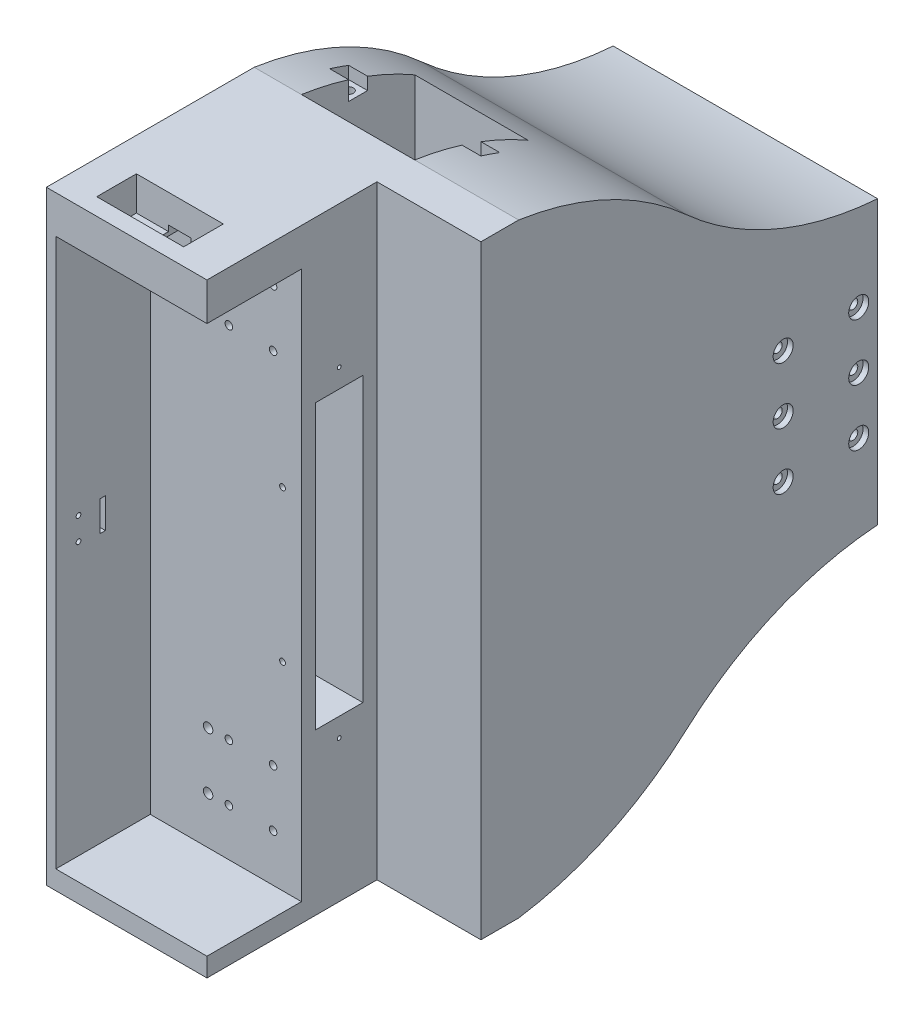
SolidWorks part; units mm, degrees
ref_plane "前视基准面" through (0, 0, 0) normal (0, 0, 1) x (1, 0, 0)
ref_plane "上视基准面" through (0, 0, 0) normal (0, 1, 0) x (1, 0, 0)
ref_plane "右视基准面" through (0, 0, 0) normal (1, 0, 0) x (0, 0, -1)
other "Configuration Table"
sketch "草图1" plane through (0, 0, 0) normal (0, 1, 0) x (1, 0, 0)
  line L0 (0, 0) -> (140, 0)
  line L1 (140, 0) -> (140, -20)
  line L2 (140, -20) -> (85, -20)
  line L3 (85, -20) -> (85, -100)
  line L4 (85, -100) -> (0, -100)
  line L5 (0, -100) -> (0, 0)
  dimension "D1" = 140
  dimension "D2" = 100
  dimension "D3" = 80
  dimension "D4" = 55
extrude "凸台-拉伸1" add sketch "草图1" along normal blind 320
sketch "草图3" plane through (85, 0, 0) normal (1, 0, 0) x (0, 0, -1)
  line L0 (-100, 0) -> (-100, 10)
  line L1 (-100, 10) -> (-50, 10)
  line L2 (-50, 10) -> (-50, 310)
  line L3 (-50, 310) -> (-100, 310)
  line L4 (-100, 0) -> (-20, 0)
  line L5 (-20, 0) -> (-20, 320)
  line L6 (-20, 320) -> (-100, 320)
  line L7 (-100, 320) -> (-100, 0)
  line L8 (-100, 0) -> (-20, 0)
  line L9 (-20, 0) -> (-20, 320)
  line L10 (-20, 320) -> (-100, 320)
  line L11 (-100, 320) -> (-100, 0)
  line L12 (-100, 310) -> (-100, 10)
  dimension "D2" = 10
  dimension "D3" = 10
  dimension "D4" = 50
  dimension "D1" = 0
extrude "切除-拉伸1" cut sketch "草图3" against normal blind 80 contours L2 L3 L1 M10
sketch "草图5" plane through (0, 0, 50) normal (0, 0, 1) x (1, 0, 0)
  line L0 (70, 10) -> (70, 35)
  line L1 (70, 35) -> (85, 35)
  line L2 (46.6, 35) -> (46.6, 65) construction
  line L3 (46.6, 65) -> (46.6, 285) construction
  line L4 (85, 10) -> (85, 310)
  line L5 (85, 310) -> (5, 310)
  line L6 (5, 310) -> (5, 10)
  line L7 (5, 10) -> (85, 10)
  line L8 (85, 10) -> (85, 310)
  line L9 (85, 310) -> (5, 310)
  line L10 (5, 310) -> (5, 10)
  line L11 (5, 10) -> (85, 10)
  circle A0 centre (70, 35) radius 2
  circle A1 centre (46.6, 35) radius 2
  circle A2 centre (46.6, 65) radius 2
  circle A3 centre (70, 65) radius 2
  circle A4 centre (46.6, 285) radius 2
  circle A5 centre (46.6, 255) radius 2
  circle A6 centre (70, 255) radius 2
  circle A7 centre (70, 285) radius 2
  dimension "D4" = 4
  dimension "D2" = 25
  dimension "D3" = 15
  dimension "D6" = 23.4
  dimension "D8" = 30
  dimension "D10" = 220
  dimension "D1" = 0
  dimension "D5" = 2
  dimension "D7" = 2
  dimension "D9" = 2
extrude "切除-拉伸2" cut sketch "草图5" against normal blind 50 contours A2 | A3 | A1 | L1 A0 L0 | L0 A0 L1 | A6 | A4 | A7 | A5
sketch "草图9" plane through (0, 0, 50) normal (0, 0, 1) x (1, 0, 0)
  line L0 (46.6, 285) -> (35.6, 285)
  line L1 (46.6, 255) -> (35.6, 255)
  line L2 (46.6, 65) -> (35.6, 65)
  line L3 (46.6, 35) -> (35.6, 35)
  circle A0 centre (46.6, 285) radius 2 construction
  circle A1 centre (46.6, 285) radius 2
  circle A2 centre (46.6, 255) radius 2 construction
  circle A3 centre (46.6, 255) radius 2
  circle A4 centre (46.6, 65) radius 2 construction
  circle A5 centre (46.6, 65) radius 2
  circle A6 centre (46.6, 35) radius 2 construction
  circle A7 centre (46.6, 35) radius 2
  circle A8 centre (35.6, 285) radius 2.5
  circle A9 centre (35.6, 255) radius 2.5
  circle A10 centre (35.6, 65) radius 2.5
  circle A11 centre (35.6, 35) radius 2.5
  dimension "D3" = 5
  dimension "D4" = 5
  dimension "D7" = 5
  dimension "D8" = 5
  dimension "D1" = 11
  dimension "D2" = 11
  dimension "D5" = 11
  dimension "D6" = 11
extrude "切除-拉伸3" cut sketch "草图9" against normal blind 50
sketch "草图11" plane through (0, 0, 0) normal (0, 0, -1) x (-1, 0, 0)
  line L4 (-140, 0) -> (0, 0)
  line L5 (0, 0) -> (0, 320)
  line L6 (0, 320) -> (-140, 320)
  line L7 (-140, 320) -> (-140, 0)
  line L8 (-140, 0) -> (0, 0)
  line L9 (0, 0) -> (0, 320)
  line L10 (0, 320) -> (-140, 320)
  line L11 (-140, 320) -> (-140, 0)
  circle A0 centre (-35.6, 35) radius 2.5 construction
  circle A1 centre (-46.6, 255) radius 2
  circle A2 centre (-46.6, 255) radius 2
  circle A3 centre (-70, 285) radius 2
  circle A4 centre (-70, 285) radius 2
  circle A5 centre (-46.6, 285) radius 2
  circle A6 centre (-46.6, 285) radius 2
  circle A7 centre (-70, 255) radius 2
  circle A8 centre (-70, 255) radius 2
  circle A9 centre (-35.6, 255) radius 2.5
  circle A10 centre (-35.6, 255) radius 2.5
  circle A11 centre (-35.6, 285) radius 2.5
  circle A12 centre (-35.6, 285) radius 2.5
  circle A13 centre (-35.6, 65) radius 2.5 construction
  circle A14 centre (-46.6, 65) radius 2 construction
  circle A15 centre (-46.6, 35) radius 2 construction
  circle A16 centre (-70, 35) radius 2 construction
  circle A17 centre (-70, 65) radius 2 construction
  circle A18 centre (-35.6, 35) radius 2.5
  circle A19 centre (-35.6, 65) radius 2.5
  circle A20 centre (-46.6, 65) radius 2
  circle A21 centre (-46.6, 35) radius 2
  circle A22 centre (-70, 35) radius 2
  circle A23 centre (-70, 65) radius 2
  dimension "D1" = 0
  dimension "D2" = 0
  dimension "D3" = 0
  dimension "D4" = 0
  dimension "D5" = 0
  dimension "D6" = 0
  dimension "D7" = 0
extrude "凸台-拉伸3" add sketch "草图11" along normal blind 10
sketch "草图12" plane through (0, 0, 20) normal (0, 0, 1) x (1, 0, 0)
  line L4 (85, 0) -> (140, 0)
  line L5 (140, 0) -> (140, 320)
  line L6 (140, 320) -> (85, 320)
  line L7 (85, 320) -> (85, 0)
  line L8 (85, 0) -> (140, 0)
  line L9 (140, 0) -> (140, 320)
  line L10 (140, 320) -> (85, 320)
  line L11 (85, 320) -> (85, 0)
  dimension "D1" = 0
extrude "切除-拉伸4" cut sketch "草图12" against normal blind 10
sketch "草图13" plane through (140, 0, 0) normal (1, 0, 0) x (0, 0, -1)
  line L0 (10, 160) -> (10, 234.75)
  line L1 (200, 160) -> (200, 85.25)
  line L2 (200, 160) -> (200, 234.75)
  line L3 (200, 160) -> (-49800, 160) construction
  line L4 (-10, 320) -> (-10, 0)
  line L5 (-10, 0) -> (10, 0)
  line L6 (10, 0) -> (10, 320)
  line L7 (10, 320) -> (-10, 320)
  line L8 (-10, 320) -> (-10, 0)
  line L9 (-10, 0) -> (10, 0)
  line L10 (10, 0) -> (10, 320)
  line L11 (10, 320) -> (-10, 320)
  arc A0 (200, 234.75) -> (98.848, 277.9963) centre (212.2529, 403.3284) cw
  arc A1 (98.848, 42.0037) -> (10, 0) centre (-14.9754, 167.7983) cw
  arc A2 (98.848, 277.9963) -> (10, 320) centre (-14.9754, 152.2017) ccw
  arc A3 (200, 85.25) -> (98.848, 42.0037) centre (212.2529, -83.3284) ccw
  dimension "D2" = 74.75
  dimension "D4" = 190
  dimension "D1" = 0
  dimension "D3" = 2
extrude "凸台-拉伸4" add sketch "草图13" against normal up to surface (140 mm away)
sketch "草图15" plane through (0, 0, 0) normal (-1, 0, 0) x (0, 0, 1)
  line L0 (-10, 320) -> (100, 320) construction
  line L1 (-10, 320) -> (100, 320)
  line L2 (-10, 0) -> (100, 0) construction
  line L3 (-10, 0) -> (100, 0)
  line L4 (-10, 0) -> (-10, 80)
  line L5 (-10, 320) -> (-10, 240)
  line L6 (-10, 80) -> (-70, 80)
  line L7 (-10, 240) -> (-70, 240)
  line L8 (-70, 80) -> (-70, 20.9677)
  line L9 (-70, 240) -> (-70, 299.0323)
  arc A0 (-98.848, 42.0037) -> (-10, 0) centre (14.9754, 167.7983) ccw construction
  arc A1 (-10, 320) -> (-98.848, 277.9963) centre (14.9754, 152.2017) ccw construction
  arc A2 (-10, 320) -> (-98.848, 277.9963) centre (14.9754, 152.2017) ccw
  arc A3 (-98.848, 42.0037) -> (-10, 0) centre (14.9754, 167.7983) ccw
  dimension "D3" = 60
  dimension "D1" = 80
  dimension "D2" = 80
  dimension "D4" = 60
extrude "切除-拉伸5" cut sketch "草图15" against normal blind 60 from offset 25 contours L6 L8 L4 M12 | L9 L7 L5 M8
sketch "草图16" plane through (85, 0, 0) normal (1, 0, 0) x (0, 0, -1)
  line L0 (-50, 160) -> (-42.5, 160)
  line L1 (-42.5, 85) -> (-42.5, 235)
  line L2 (-42.5, 235) -> (-17.5, 235)
  line L3 (-17.5, 235) -> (-17.5, 85)
  line L4 (-17.5, 160) -> (-42.5, 160)
  line L5 (-42.5, 85) -> (-17.5, 85)
  line L8 (-50, 310) -> (-50, 10)
  line L9 (-50, 10) -> (-100, 10)
  line L10 (-100, 10) -> (-100, 0)
  line L11 (-100, 0) -> (-10, 0)
  line L12 (-10, 0) -> (-10, 320)
  line L13 (-10, 320) -> (-100, 320)
  line L14 (-100, 320) -> (-100, 310)
  line L15 (-100, 310) -> (-50, 310)
  line L16 (-50, 310) -> (-50, 10)
  line L17 (-50, 10) -> (-100, 10)
  line L18 (-100, 10) -> (-100, 0)
  line L19 (-100, 0) -> (-10, 0)
  line L20 (-10, 0) -> (-10, 320)
  line L21 (-10, 320) -> (-100, 320)
  line L22 (-100, 320) -> (-100, 310)
  line L23 (-100, 310) -> (-50, 310)
  dimension "D2" = 7.5
  dimension "D3" = 25
  dimension "D4" = 75
  dimension "D1" = 0
extrude "切除-拉伸6" cut sketch "草图16" against normal blind 60 contours L4 L3 L2 L1 | L1 L5 L3 L4
sketch "草图17" plane through (0, 0, -200) normal (0, 0, -1) x (-1, 0, 0)
  line L1 (-120, 204.75) -> (-20, 204.75)
  line L2 (-120, 204.75) -> (-120, 115.25)
  line L3 (-120, 115.25) -> (-20, 115.25)
  line L4 (0, 85.25) -> (0, 234.75)
  line L5 (0, 234.75) -> (-140, 234.75)
  line L6 (-140, 234.75) -> (-140, 85.25)
  line L7 (-140, 85.25) -> (0, 85.25)
  line L8 (0, 85.25) -> (0, 234.75)
  line L9 (0, 234.75) -> (-140, 234.75)
  line L10 (-140, 234.75) -> (-140, 85.25)
  line L11 (-140, 85.25) -> (0, 85.25)
  line L12 (-20, 204.75) -> (-20, 115.25)
  line L13 (-120, 204.75) -> (-20, 115.25) construction
  line L14 (-120, 115.25) -> (-20, 204.75) construction
  point P2 (-70, 160)
  dimension "D2" = 100
  dimension "D3" = 89.5
  dimension "D4" = 20
  dimension "D5" = 30
  dimension "D1" = 0
extrude "切除-拉伸8" cut sketch "草图17" against normal blind 61 contours L12 L1 L2 L3
sketch "草图19" plane through (20, 0, 0) normal (1, 0, 0) x (0, 0, -1)
  line L0 (200, 160) -> (139, 160)
  line L1 (190, 160) -> (150, 160) construction
  line L2 (190, 160) -> (190, 190) construction
  line L4 (200, 115.25) -> (200, 204.75)
  line L5 (200, 204.75) -> (139, 204.75)
  line L6 (139, 204.75) -> (139, 115.25)
  line L7 (139, 115.25) -> (200, 115.25)
  line L8 (200, 115.25) -> (200, 204.75)
  line L9 (200, 204.75) -> (139, 204.75)
  line L10 (139, 204.75) -> (139, 115.25)
  line L11 (139, 115.25) -> (200, 115.25)
  circle A0 centre (190, 160) radius 2.5
  circle A1 centre (150, 160) radius 2.5
  circle A2 centre (150, 190) radius 2.5
  circle A3 centre (190, 190) radius 2.5
  circle A4 centre (150, 130) radius 2.5
  circle A5 centre (190, 130) radius 2.5
  dimension "D2" = 5
  dimension "D3" = 10
  dimension "D6" = 40
  dimension "D7" = 30
  dimension "D1" = 0
  dimension "D4" = 2
  dimension "D5" = 2
extrude "切除-拉伸9" cut sketch "草图19" against normal through all both and the other way through all contours A3 | A2 | A1 | A0 | A5 | A4
sketch "草图20" plane through (140, 0, 0) normal (1, 0, 0) x (0, 0, -1)
  circle A0 centre (150, 130) radius 2.5 construction
  circle A1 centre (190, 130) radius 2.5 construction
  circle A2 centre (190, 160) radius 2.5 construction
  circle A3 centre (150, 160) radius 2.5 construction
  circle A4 centre (150, 190) radius 2.5 construction
  circle A5 centre (190, 190) radius 2.5 construction
  circle A6 centre (150, 130) radius 2.5
  circle A7 centre (190, 130) radius 2.5
  circle A8 centre (190, 160) radius 2.5
  circle A9 centre (150, 160) radius 2.5
  circle A10 centre (150, 190) radius 2.5
  circle A11 centre (190, 190) radius 2.5
  circle A12 centre (190, 190) radius 5.3
  circle A13 centre (150, 190) radius 5.3
  circle A14 centre (150, 160) radius 5.3
  circle A15 centre (190, 160) radius 5.3
  circle A16 centre (190, 130) radius 5.3
  circle A17 centre (150, 130) radius 5.3
  dimension "D1" = 10.6
  dimension "D2" = 10.6
  dimension "D3" = 10.6
  dimension "D4" = 10.6
  dimension "D5" = 10.6
  dimension "D6" = 10.6
extrude "切除-拉伸10" cut sketch "草图20" against normal blind 3 and the other way through all
sketch "草图21" plane through (0, 0, 0) normal (-1, 0, 0) x (0, 0, 1)
  circle A0 centre (-150, 130) radius 5.3 construction
  circle A1 centre (-150, 160) radius 5.3
  circle A2 centre (-150, 160) radius 5.3
  circle A3 centre (-150, 190) radius 5.3 construction
  circle A4 centre (-190, 190) radius 5.3 construction
  circle A5 centre (-190, 160) radius 5.3 construction
  circle A6 centre (-190, 130) radius 5.3 construction
  circle A7 centre (-150, 130) radius 5.3
  circle A8 centre (-150, 190) radius 5.3
  circle A9 centre (-190, 190) radius 5.3
  circle A10 centre (-190, 160) radius 5.3
  circle A11 centre (-190, 130) radius 5.3
  dimension "D1" = 0
extrude "切除-拉伸11" cut sketch "草图21" against normal blind 3
sketch "草图22" plane through (0, 0, -139) normal (0, 0, -1) x (-1, 0, 0)
  line L0 (-70, 204.75) -> (-70, 115.25)
  line L1 (-120, 160) -> (-20, 160)
  line L3 (-105.5, 195.5) -> (-34.5, 195.5)
  line L4 (-20, 115.25) -> (-20, 204.75)
  line L5 (-20, 204.75) -> (-120, 204.75)
  line L6 (-120, 204.75) -> (-120, 115.25)
  line L7 (-120, 115.25) -> (-20, 115.25)
  line L8 (-20, 115.25) -> (-20, 204.75)
  line L9 (-20, 204.75) -> (-120, 204.75)
  line L10 (-120, 204.75) -> (-120, 115.25)
  line L11 (-120, 115.25) -> (-20, 115.25)
  line L12 (-105.5, 195.5) -> (-105.5, 124.5)
  line L13 (-105.5, 124.5) -> (-34.5, 124.5)
  line L14 (-34.5, 195.5) -> (-34.5, 124.5)
  line L15 (-105.5, 195.5) -> (-34.5, 124.5) construction
  line L16 (-105.5, 124.5) -> (-34.5, 195.5) construction
  point P8 (-70, 160)
  dimension "D2" = 71
  dimension "D3" = 71
  dimension "D1" = 0
extrude "切除-拉伸12" cut sketch "草图22" against normal blind 71 contours L3 L12 L1 L0 | L14 L3 L0 L1 | L14 L1 L0 L13 | L12 L13 L0 L1
sketch "草图23" plane through (0, 0, 0) normal (-1, 0, 0) x (0, 0, 1)
  line L0 (100, 160) -> (90, 160)
  line L1 (90, 170) -> (90, 150)
  line L2 (90, 150) -> (70, 150)
  line L3 (70, 150) -> (70, 170)
  line L4 (-10, 0) -> (100, 0)
  line L5 (100, 0) -> (100, 320)
  line L6 (100, 320) -> (-10, 320)
  line L7 (-200, 234.75) -> (-200, 85.25)
  line L8 (-10, 0) -> (100, 0)
  line L9 (100, 0) -> (100, 320)
  line L10 (100, 320) -> (-10, 320)
  line L11 (-200, 234.75) -> (-200, 85.25)
  line L12 (70, 160) -> (90, 160)
  line L13 (90, 170) -> (70, 170)
  arc A4 (-10, 320) -> (-98.848, 277.9963) centre (14.9754, 152.2017) ccw
  arc A5 (-200, 234.75) -> (-98.848, 277.9963) centre (-212.2529, 403.3284) ccw
  arc A6 (-98.848, 42.0037) -> (-200, 85.25) centre (-212.2529, -83.3284) ccw
  arc A7 (-98.848, 42.0037) -> (-10, 0) centre (14.9754, 167.7983) ccw
  arc A8 (-10, 320) -> (-98.848, 277.9963) centre (14.9754, 152.2017) ccw
  arc A9 (-200, 234.75) -> (-98.848, 277.9963) centre (-212.2529, 403.3284) ccw
  arc A10 (-98.848, 42.0037) -> (-200, 85.25) centre (-212.2529, -83.3284) ccw
  arc A11 (-98.848, 42.0037) -> (-10, 0) centre (14.9754, 167.7983) ccw
  dimension "D2" = 10
  dimension "D3" = 20
  dimension "D4" = 10
  dimension "D1" = 0
extrude "切除-拉伸13" cut sketch "草图23" against normal blind 2 contours L12 L3 L2 L1 | L1 L13 L3 L12
sketch "草图24" plane through (2, 0, 0) normal (-1, 0, 0) x (0, 0, 1)
  line L0 (70, 152) -> (73.75, 152)
  line L1 (73.75, 152) -> (73.75, 150)
  line L3 (73.75, 152) -> (76.75, 152)
  line L4 (90, 150) -> (90, 170)
  line L5 (90, 170) -> (70, 170)
  line L6 (70, 170) -> (70, 150)
  line L7 (70, 150) -> (90, 150)
  line L8 (90, 150) -> (90, 170)
  line L9 (90, 170) -> (70, 170)
  line L10 (70, 170) -> (70, 150)
  line L11 (70, 150) -> (90, 150)
  line L12 (73.75, 152) -> (73.75, 168)
  line L13 (73.75, 168) -> (76.75, 168)
  line L14 (76.75, 152) -> (76.75, 168)
  dimension "D2" = 3.75
  dimension "D3" = 2
  dimension "D4" = 16
  dimension "D5" = 3
  dimension "D1" = 0
extrude "切除-拉伸14" cut sketch "草图24" against normal blind 12 contours L3 L14 L13 L12
sketch "草图25" plane through (2, 0, 0) normal (-1, 0, 0) x (0, 0, 1)
  line L0 (90, 160) -> (88, 160)
  line L1 (88, 160) -> (88, 166)
  line L4 (90, 150) -> (90, 170)
  line L5 (90, 170) -> (70, 170)
  line L6 (70, 170) -> (70, 150)
  line L7 (70, 150) -> (90, 150)
  line L8 (90, 150) -> (90, 170)
  line L9 (90, 170) -> (70, 170)
  line L10 (70, 170) -> (70, 150)
  line L11 (70, 150) -> (90, 150)
  circle A0 centre (88, 166) radius 1.25
  circle A1 centre (88, 154) radius 1.25
  dimension "D4" = 2.5
  dimension "D2" = 2
  dimension "D3" = 6
  dimension "D1" = 0
extrude "切除-拉伸15" cut sketch "草图25" against normal blind 12
sketch "草图26" plane through (0, 10, 0) normal (0, 1, 0) x (1, 0, 0)
  line L4 (85, -100) -> (85, -50)
  line L5 (85, -50) -> (5, -50)
  line L6 (5, -50) -> (5, -100)
  line L7 (5, -100) -> (85, -100)
  line L8 (85, -100) -> (85, -50)
  line L9 (85, -50) -> (5, -50)
  line L10 (5, -50) -> (5, -100)
  line L11 (5, -100) -> (85, -100)
  dimension "D1" = 0
extrude "凸台-拉伸5" add sketch "草图26" along normal blind 10
sketch "草图28" plane through (0, 0, 0) normal (0, -1, 0) x (1, 0, 0)
  line L0 (0, -10) -> (0, 100) construction
  line L1 (0, -10) -> (0, 100)
  line L2 (40.6621, 100) -> (40.6621, 91)
  line L3 (40.6621, 91) -> (17.6621, 91)
  line L4 (17.6621, 91) -> (17.6621, 70)
  line L5 (17.6621, 70) -> (63.6621, 70)
  line L6 (63.6621, 70) -> (63.6621, 91)
  line L7 (63.6621, 91) -> (40.6621, 91)
  line L10 (140, 10) -> (85, 10)
  line L11 (85, 10) -> (85, 100)
  line L12 (85, 100) -> (0, 100)
  line L13 (0, 100) -> (0, -10)
  line L14 (0, -10) -> (25, -10)
  line L15 (25, -10) -> (85, -10)
  line L16 (85, -10) -> (140, -10)
  line L17 (140, -10) -> (140, 10)
  line L18 (140, 10) -> (85, 10)
  line L19 (85, 10) -> (85, 100)
  line L20 (85, 100) -> (0, 100)
  line L21 (0, 100) -> (0, -10)
  line L22 (0, -10) -> (25, -10)
  line L23 (25, -10) -> (85, -10)
  line L24 (85, -10) -> (140, -10)
  line L25 (140, -10) -> (140, 10)
  dimension "D2" = 9
  dimension "D3" = 46
  dimension "D4" = 23
  dimension "D5" = 21
  dimension "D1" = 0
extrude "切除-拉伸16" cut sketch "草图28" against normal blind 18 contours L6 L7 L3 L4 L5
sketch "草图29" plane through (0, 18, 0) normal (0, -1, 0) x (1, 0, 0)
  line L0 (40.6621, 70) -> (46.6621, 70)
  line L1 (46.6621, 70) -> (46.6621, 75)
  line L2 (46.6621, 75) -> (34.6621, 75)
  line L3 (34.6621, 75) -> (34.6621, 70)
  line L4 (63.6621, 70) -> (63.6621, 91)
  line L5 (63.6621, 91) -> (17.6621, 91)
  line L6 (17.6621, 91) -> (17.6621, 70)
  line L7 (17.6621, 70) -> (63.6621, 70)
  line L8 (63.6621, 70) -> (63.6621, 91)
  line L9 (63.6621, 91) -> (17.6621, 91)
  line L10 (17.6621, 91) -> (17.6621, 70)
  line L11 (17.6621, 70) -> (63.6621, 70)
  line L12 (34.6621, 70) -> (40.6621, 70)
  dimension "D2" = 12
  dimension "D3" = 5
  dimension "D4" = 6
  dimension "D1" = 0
extrude "切除-拉伸17" cut sketch "草图29" against normal blind 10 contours L2 L3 L1 M13
sketch "草图30" plane through (0, 20, 0) normal (0, 1, 0) x (1, 0, 0)
  line L0 (46.6621, -70) -> (34.6621, -70) construction
  line L1 (46.6621, -70) -> (34.6621, -70)
  line L2 (46.6621, -75) -> (46.6621, -70) construction
  line L3 (46.6621, -75) -> (46.6621, -70)
  line L4 (5, -100) -> (85, -100)
  line L5 (85, -100) -> (85, -50)
  line L6 (85, -50) -> (5, -50)
  line L7 (5, -50) -> (5, -100)
  line L8 (5, -100) -> (85, -100)
  line L9 (85, -100) -> (85, -50)
  line L10 (85, -50) -> (5, -50)
  line L11 (5, -50) -> (5, -100)
  line L12 (34.6621, -75) -> (46.6621, -75) construction
  line L13 (34.6621, -70) -> (34.6621, -75) construction
  line L14 (34.6621, -75) -> (46.6621, -75)
  line L15 (34.6621, -70) -> (34.6621, -75)
  line L16 (34.6621, -70) -> (34.6621, -60)
  line L17 (34.6621, -60) -> (46.6621, -60)
  line L18 (46.6621, -60) -> (46.6621, -70)
  dimension "D2" = 10
  dimension "D1" = 0
extrude "切除-拉伸18" cut sketch "草图30" against normal blind 5 contours L18 L17 L16 M8
sketch "草图31" plane through (0, 310, 0) normal (0, -1, 0) x (1, 0, 0)
  line L4 (85, 50) -> (85, 100)
  line L5 (85, 100) -> (5, 100)
  line L6 (5, 100) -> (5, 50)
  line L7 (5, 50) -> (85, 50)
  line L8 (85, 50) -> (85, 100)
  line L9 (85, 100) -> (5, 100)
  line L10 (5, 100) -> (5, 50)
  line L11 (5, 50) -> (85, 50)
  dimension "D1" = 0
extrude "凸台-拉伸6" add sketch "草图31" along normal blind 10
sketch "草图32" plane through (0, 320, 0) normal (0, 1, 0) x (1, 0, 0)
  line L0 (63.6621, -91) -> (17.6621, -91) construction
  line L1 (63.6621, -70) -> (63.6621, -91) construction
  line L2 (17.6621, -70) -> (63.6621, -70) construction
  line L3 (17.6621, -91) -> (17.6621, -70) construction
  line L4 (63.6621, -91) -> (17.6621, -91)
  line L5 (63.6621, -70) -> (63.6621, -91)
  line L6 (17.6621, -70) -> (63.6621, -70)
  line L7 (17.6621, -91) -> (17.6621, -70)
  line L8 (85, -100) -> (85, -10)
  line L9 (85, -10) -> (140, -10)
  line L10 (140, -10) -> (140, 10)
  line L11 (140, 10) -> (85, 10)
  line L12 (85, 10) -> (25, 10)
  line L13 (25, 10) -> (0, 10)
  line L14 (0, 10) -> (0, -100)
  line L15 (0, -100) -> (85, -100)
  line L16 (85, -100) -> (85, -10)
  line L17 (85, -10) -> (140, -10)
  line L18 (140, -10) -> (140, 10)
  line L19 (140, 10) -> (85, 10)
  line L20 (85, 10) -> (25, 10)
  line L21 (25, 10) -> (0, 10)
  line L22 (0, 10) -> (0, -100)
  line L23 (0, -100) -> (85, -100)
  dimension "D1" = 0
extrude "切除-拉伸19" cut sketch "草图32" against normal blind 18 contours L7 L4 L5 L6
sketch "草图33" plane through (0, 300, 0) normal (0, -1, 0) x (1, 0, 0)
  line L0 (34.6621, 75) -> (46.6621, 75) construction
  line L1 (34.6621, 60) -> (34.6621, 75) construction
  line L2 (34.6621, 60) -> (46.6621, 60) construction
  line L3 (46.6621, 75) -> (46.6621, 60) construction
  line L4 (34.6621, 75) -> (46.6621, 75)
  line L5 (34.6621, 60) -> (34.6621, 75)
  line L6 (34.6621, 60) -> (46.6621, 60)
  line L7 (46.6621, 75) -> (46.6621, 60)
extrude "切除-拉伸20" cut sketch "草图33" against normal blind 5
sketch "草图34" plane through (0, 20, 0) normal (0, 1, 0) x (1, 0, 0)
  line L4 (5, -100) -> (85, -100)
  line L5 (85, -100) -> (85, -50)
  line L6 (85, -50) -> (5, -50)
  line L7 (5, -50) -> (5, -100)
  line L8 (5, -100) -> (85, -100)
  line L9 (85, -100) -> (85, -50)
  line L10 (85, -50) -> (5, -50)
  line L11 (5, -50) -> (5, -100)
  dimension "D1" = 0
extrude "凸台-拉伸7" add sketch "草图34" against normal blind 20
sketch "草图35" plane through (0, 20, 0) normal (0, 1, 0) x (1, 0, 0)
  line L4 (5, -100) -> (85, -100)
  line L5 (85, -100) -> (85, -50)
  line L6 (85, -50) -> (5, -50)
  line L7 (5, -50) -> (5, -100)
  line L8 (5, -100) -> (85, -100)
  line L9 (85, -100) -> (85, -50)
  line L10 (85, -50) -> (5, -50)
  line L11 (5, -50) -> (5, -100)
  dimension "D1" = 0
extrude "切除-拉伸21" cut sketch "草图35" against normal blind 10
sketch "草图36" plane through (85, 0, 0) normal (1, 0, 0) x (0, 0, -1)
  line L0 (-30, 235) -> (-30, 245)
  line L1 (-30, 85) -> (-30, 75)
  line L4 (-42.5, 235) -> (-42.5, 85)
  line L5 (-42.5, 85) -> (-17.5, 85)
  line L6 (-17.5, 85) -> (-17.5, 235)
  line L7 (-17.5, 235) -> (-42.5, 235)
  line L8 (-50, 300) -> (-50, 10)
  line L9 (-50, 10) -> (-100, 10)
  line L10 (-100, 10) -> (-100, 0)
  line L11 (-100, 0) -> (-10, 0)
  line L12 (-10, 0) -> (-10, 320)
  line L13 (-10, 320) -> (-100, 320)
  line L14 (-100, 320) -> (-100, 300)
  line L15 (-100, 300) -> (-50, 300)
  line L16 (-50, 300) -> (-50, 10)
  line L17 (-50, 10) -> (-100, 10)
  line L18 (-100, 10) -> (-100, 0)
  line L19 (-100, 0) -> (-10, 0)
  line L20 (-10, 0) -> (-10, 320)
  line L21 (-10, 320) -> (-100, 320)
  line L22 (-100, 320) -> (-100, 300)
  line L23 (-100, 300) -> (-50, 300)
  line L24 (-42.5, 235) -> (-42.5, 85)
  line L25 (-42.5, 85) -> (-17.5, 85)
  line L26 (-17.5, 85) -> (-17.5, 235)
  line L27 (-17.5, 235) -> (-42.5, 235)
  circle A0 centre (-30, 245) radius 1
  circle A1 centre (-30, 75) radius 1
  dimension "D5" = 2
  dimension "D6" = 2
  dimension "D3" = 10
  dimension "D4" = 10
  dimension "D1" = 0
  dimension "D2" = 0
extrude "切除-拉伸22" cut sketch "草图36" against normal blind 20 contours A0 | A1
sketch "草图37" plane through (0, 0, 50) normal (0, 0, 1) x (1, 0, 0)
  line L0 (85, 155) -> (75, 155)
  line L1 (75, 155) -> (75, 195)
  line L4 (85, 10) -> (85, 300)
  line L5 (85, 300) -> (5, 300)
  line L6 (5, 300) -> (5, 10)
  line L7 (5, 10) -> (85, 10)
  line L8 (85, 10) -> (85, 300)
  line L9 (85, 300) -> (5, 300)
  line L10 (5, 300) -> (5, 10)
  line L11 (5, 10) -> (85, 10)
  circle A0 centre (75, 195) radius 1.55
  circle A1 centre (75, 115) radius 1.55
  dimension "D4" = 3.1
  dimension "D2" = 10
  dimension "D3" = 40
  dimension "D1" = 0
extrude "切除-拉伸23" cut sketch "草图37" against normal blind 20 contours A0 | A1
sketch "草图38" plane through (0, 0, 0) normal (-1, 0, 0) x (0, 0, 1)
  line L0 (-10, 320) -> (-10, 304.32)
  line L1 (-8.0759, 304.32) -> (-10, 304.32)
  line L2 (-10, 304.32) -> (-35, 304.32)
  line L3 (-70, 299.0323) -> (-70, 240)
  line L4 (-10, 0) -> (100, 0)
  line L5 (100, 0) -> (100, 320)
  line L6 (100, 320) -> (-10, 320)
  line L7 (-200, 234.75) -> (-200, 85.25)
  line L8 (-10, 0) -> (100, 0)
  line L9 (100, 0) -> (100, 320)
  line L10 (100, 320) -> (-10, 320)
  line L11 (-200, 234.75) -> (-200, 85.25)
  line L12 (-70, 240) -> (-10, 240)
  line L13 (-10, 240) -> (-10, 320)
  line L14 (-70, 299.0323) -> (-70, 240)
  line L15 (-70, 240) -> (-10, 240)
  line L17 (-35, 304.32) -> (-35, 314.3205)
  line L18 (-35, 304.32) -> (-45, 304.32)
  line L19 (-45, 304.32) -> (-45, 310.8932)
  line L20 (100, 160) -> (-49900, 160) construction
  line L21 (-35, 15.68) -> (-35, 5.6795)
  line L22 (-45, 15.68) -> (-45, 9.1068)
  line L23 (-35, 15.68) -> (-45, 15.68)
  arc A0 (-10, 0) -> (-70, 20.9677) centre (14.9754, 167.7983) cw
  arc A1 (-10, 320) -> (-70, 299.0323) centre (14.9754, 152.2017) ccw
  arc A2 (-10, 320) -> (-70, 299.0323) centre (14.9754, 152.2017) ccw
  arc A4 (-10, 320) -> (-98.848, 277.9963) centre (14.9754, 152.2017) ccw
  arc A5 (-200, 234.75) -> (-98.848, 277.9963) centre (-212.2529, 403.3284) ccw
  arc A6 (-98.848, 42.0037) -> (-200, 85.25) centre (-212.2529, -83.3284) ccw
  arc A7 (-98.848, 42.0037) -> (-10, 0) centre (14.9754, 167.7983) ccw
  arc A9 (-200, 234.75) -> (-98.848, 277.9963) centre (-212.2529, 403.3284) ccw
  arc A10 (-98.848, 42.0037) -> (-200, 85.25) centre (-212.2529, -83.3284) ccw
  arc A11 (-98.848, 42.0037) -> (-10, 0) centre (14.9754, 167.7983) ccw
  point P24 (100, 160)
  dimension "D3" = 15.68
  dimension "D4" = 25
  dimension "D5" = 10
  dimension "D1" = 0
  dimension "D2" = 0
extrude "切除-拉伸24" cut sketch "草图38" against normal blind 80 from offset 15 contours L19 L18 L17 M17 | L21 L23 L22 M21
sketch "草图39" plane through (0, 15.68, 0) normal (0, -1, 0) x (1, 0, 0)
  line L0 (20, -35) -> (20, -45)
  line L1 (55, -10) -> (55, -50010) construction
  line L4 (25, -35) -> (15, -35)
  line L5 (15, -35) -> (15, -45)
  line L6 (15, -45) -> (25, -45)
  line L7 (25, -45) -> (25, -35)
  line L8 (25, -35) -> (15, -35)
  line L9 (15, -35) -> (15, -45)
  line L10 (15, -45) -> (25, -45)
  line L11 (25, -45) -> (25, -35)
  line L12 (85, -35) -> (85, -45)
  line L13 (85, -45) -> (95, -45)
  line L14 (95, -45) -> (95, -35)
  line L15 (95, -35) -> (85, -35)
  line L16 (85, -35) -> (85, -45)
  line L17 (85, -45) -> (95, -45)
  line L18 (95, -45) -> (95, -35)
  line L19 (95, -35) -> (85, -35)
  line L20 (25, -10) -> (25, -70)
  line L21 (25, -70) -> (85, -70)
  line L22 (85, -70) -> (85, -10)
  line L23 (85, -10) -> (25, -10)
  line L24 (25, -10) -> (25, -70)
  line L25 (25, -70) -> (85, -70)
  line L26 (85, -70) -> (85, -10)
  line L27 (85, -10) -> (25, -10)
  circle A0 centre (20, -40) radius 2.5
  circle A1 centre (90, -40) radius 2.5
  point P18 (55, -10)
  dimension "D4" = 5
  dimension "D1" = 0
  dimension "D2" = 0
  dimension "D3" = 0
extrude "切除-拉伸25" cut sketch "草图39" against normal blind 20 contours A0 | A1
sketch "草图40" plane through (0, 304.32, 0) normal (0, 1, 0) x (1, 0, 0)
  circle A0 centre (90, 40) radius 2.5 construction
  circle A1 centre (90, 40) radius 2.5
  circle A2 centre (20, 40) radius 2.5 construction
  circle A3 centre (20, 40) radius 2.5
extrude "切除-拉伸26" cut sketch "草图40" against normal blind 20
